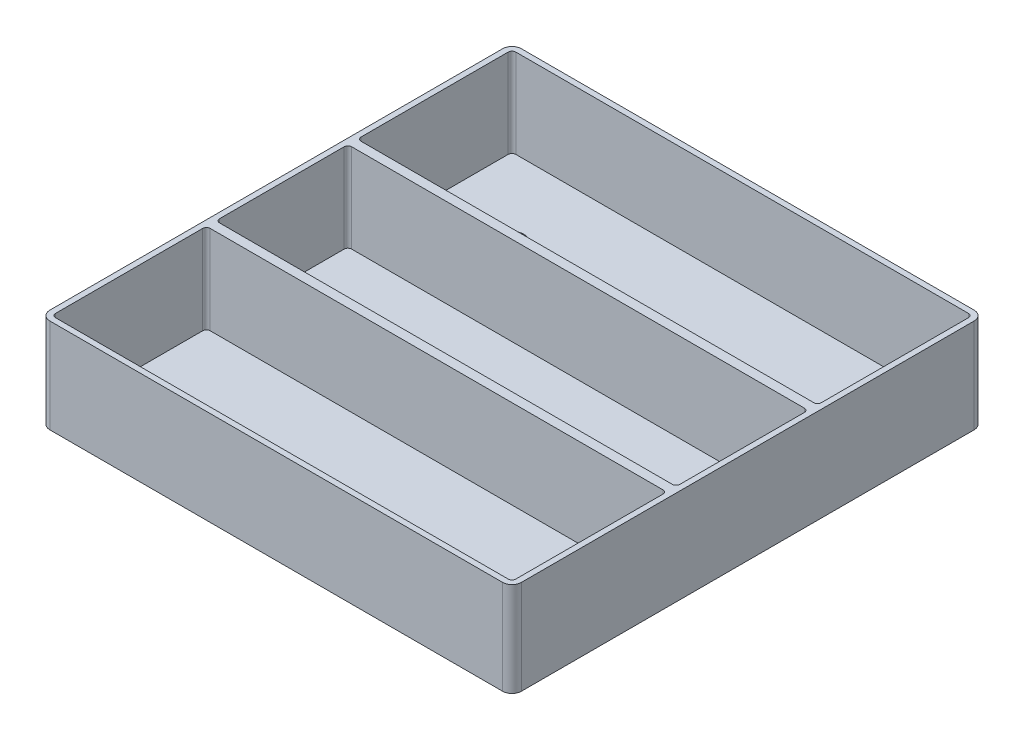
SolidWorks part; units mm, degrees
ref_plane "Front Plane" through (0, 0, 0) normal (0, 0, 1) x (1, 0, 0)
ref_plane "Top Plane" through (0, 0, 0) normal (0, 1, 0) x (1, 0, 0)
ref_plane "Right Plane" through (0, 0, 0) normal (1, 0, 0) x (0, 0, -1)
sketch "Profile Sketch" plane through (0, 0, 0) normal (0, 1, 0) x (1, 0, 0)
  line L0 (-63.5, -63.5) -> (63.5, 63.5) construction
  line L1 (-63.5, 63.5) -> (63.5, 63.5)
  line L2 (-63.5, 63.5) -> (-63.5, -63.5)
  line L3 (-63.5, -63.5) -> (63.5, -63.5)
  line L4 (63.5, 63.5) -> (63.5, -63.5)
  dimension "D1" = 127
  dimension "D2" = 127
extrude "Extrude1" add sketch "Profile Sketch" along normal blind 25.4
fillet "Fillet1" radius 2.54 4 edges at (-63.5, 12.7, -63.5) (63.5, 12.7, -63.5) (63.5, 12.7, 63.5) (-63.5, 12.7, 63.5)
shell "Shell3" thickness 1.524
sketch "Rib Sketch for Pockets" plane through (0, 25.4, 0) normal (0, 1, 0) x (-1, 0, 0)
  line L0 (61.976, -19.05) -> (-61.976, -19.05)
  line L1 (61.976, -60.96) -> (61.976, 60.96) construction
  line L2 (-61.976, 60.96) -> (-61.976, -60.96) construction
  line L3 (-61.976, 19.05) -> (61.976, 19.05)
  dimension "D1" = 38.1
  dimension "D2" = 19.05
rib "Rib11" sketch "Rib Sketch for Pockets" sketch "Rib Sketch for Pockets" thickness 2.54 extrusion direction normal to sketch draft on no parameters "D1"=2.54
fillet "Fillet2" radius 1.016 8 edges at (61.976, 13.462, 20.32) (-61.976, 13.462, 20.32) (61.976, 13.462, 17.78) (-61.976, 13.462, 17.78) (-61.976, 13.462, -20.32) (61.976, 13.462, -20.32) (-61.976, 13.462, -17.78) (61.976, 13.462, -17.78)
sketch "Holes Sketch" plane through (0, 1.524, 0) normal (0, 1, 0) x (-1, 0, 0)
  line L0 (-44.45, 41.275) -> (-16.6716, 41.275) construction
  line L1 (-44.45, -41.275) -> (-15.9541, -41.275) construction
  line L2 (-44.45, 41.275) -> (-44.45, 13.813) construction
  line L3 (41.275, 41.275) -> (41.275, 10.8193) construction
  circle A0 centre (-44.45, -41.275) radius 3.175
  circle A1 centre (41.275, -41.275) radius 3.175
  circle A2 centre (-44.45, 41.275) radius 3.175
  circle A3 centre (41.275, 41.275) radius 3.175
  dimension "D1" = 6.35
  dimension "D2" = 82.55
  dimension "D3" = 82.55
  dimension "D4" = 41.275
  dimension "D5" = 41.275
extrude "Cut-Extrude2" cut sketch "Holes Sketch" against normal through all
